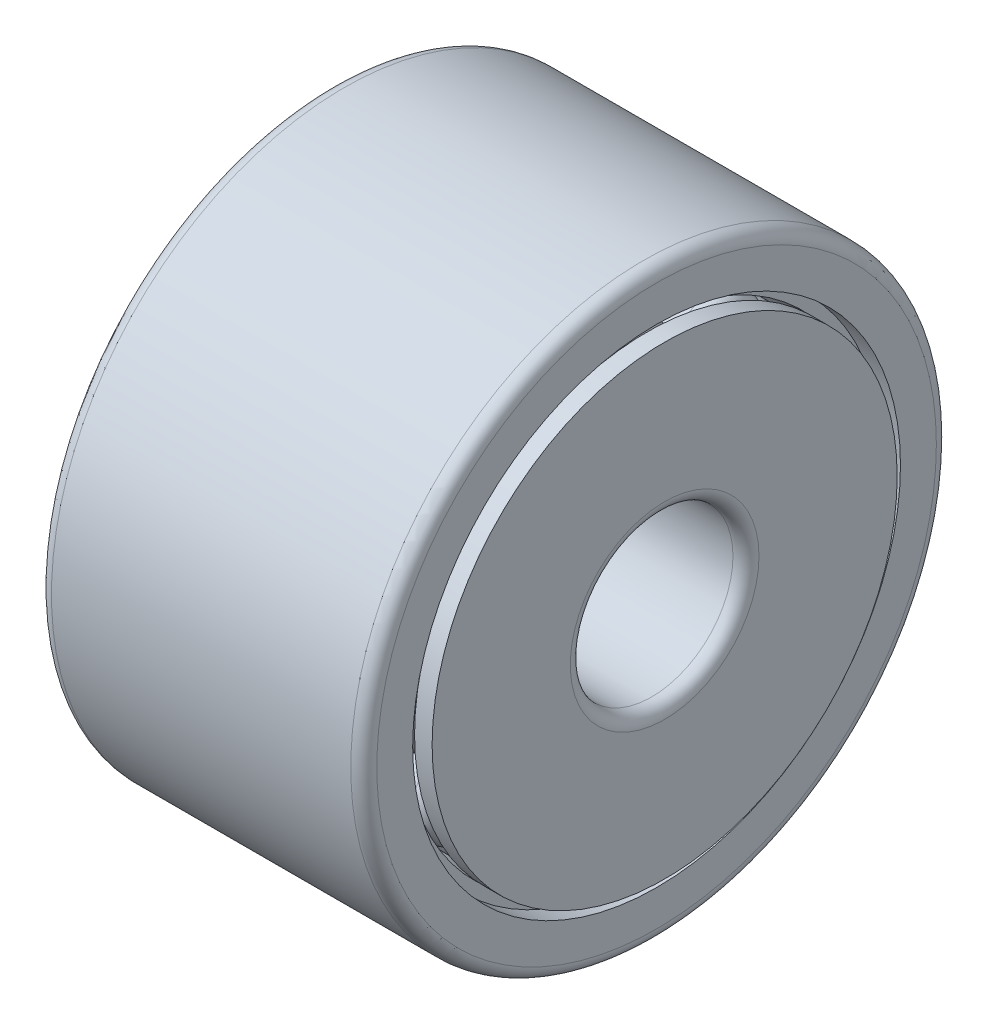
SolidWorks part; units mm, degrees
ref_plane "Plane1" through (0, 0, 0) normal (0, 0, 1) x (1, 0, 0)
ref_plane "Plane2" through (0, 0, 0) normal (0, 1, 0) x (1, 0, 0)
ref_plane "Plane3" through (0, 0, 0) normal (1, 0, 0) x (0, 0, -1)
other "Configuration Table"
sketch "Clipboard" plane through (0, 0, 0) normal (0, 0, 1) x (1, 0, 0)
  line L0 (-10, 0) -> (10, 0) construction
  line L1 (0, 0) -> (27.0344, -5.7463)
  line L2 (0, 0) -> (22.4793, 28.7722)
  line L3 (0, 0) -> (27.9428, -35.7651)
  line L4 (0, 0) -> (-22.3471, -0.7804)
sketch "OutRacSke" plane through (0, 0, 0) normal (0, 0, 1) x (1, 0, 0)
  line L0 (-14.0229, 22.6933) -> (-14.0229, 23.8026)
  line L1 (-14.0229, 23.8026) -> (-15.875, 23.8026)
  line L2 (-15.875, 23.8026) -> (-15.875, 27.305)
  line L3 (-14.605, 28.575) -> (14.605, 28.575)
  line L4 (15.875, 27.305) -> (15.875, 23.8026)
  line L5 (15.875, 23.8026) -> (14.0229, 23.8026)
  line L6 (14.0229, 23.8026) -> (14.0229, 22.6933)
  line L7 (14.0229, 22.6933) -> (-14.0229, 22.6933)
  line L8 (-7.9375, 0) -> (7.9375, 0) construction
  arc A0 (-15.875, 27.305) -> (-14.605, 28.575) centre (-14.605, 27.305) cw
  arc A1 (14.605, 28.575) -> (15.875, 27.305) centre (14.605, 27.305) cw
revolve "OuterRace" add sketch "OutRacSke" angle 360 about L8
sketch "RolDetSke" plane through (0, 0, 0) normal (0, 0, 1) x (1, 0, 0)
  line L0 (-14.0229, 20.9188) -> (-14.0229, 18.2562)
  line L1 (-14.0229, 18.2562) -> (14.0229, 18.2562)
  line L2 (14.0229, 18.2562) -> (14.0229, 20.9188)
  line L3 (12.2479, 22.6938) -> (-12.2479, 22.6938)
  line L4 (-28.575, 18.2562) -> (28.575, 18.2562) construction
  arc A0 (14.0229, 20.9188) -> (12.2479, 22.6938) centre (12.2479, 20.9188) ccw
  arc A1 (-12.2479, 22.6938) -> (-14.0229, 20.9188) centre (-12.2479, 20.9188) ccw
revolve "RollerDetailed" add sketch "RolDetSke" angle 360 about L4
ref_axis "Axis1" through (-50, 0, 0) along (1, 0, 0)
pattern_circular "RollersDetailed" count 12 every 30 about axis through (-50, 0, 0) along (1, 0, 0) of "RollerDetailed", "OuterRace"
sketch "RolSimSke" plane through (0, 25.4, 0) normal (0, 0, 1) x (1, 0, 0)
  line L0 (-14.0229, -4.4807) -> (-14.0229, -9.8058)
  line L1 (-25.4, -25.4) -> (25.4, -25.4) construction
  line L2 (14.0229, -9.8058) -> (14.0229, -4.4807)
  line L3 (12.2479, -2.7057) -> (-12.2479, -2.7057)
  line L5 (12.2479, -11.5808) -> (-12.2479, -11.5808)
  arc A0 (14.0229, -4.4807) -> (12.2479, -2.7057) centre (12.2479, -4.4807) ccw
  arc A1 (-12.2479, -2.7057) -> (-14.0229, -4.4807) centre (-12.2479, -4.4807) ccw
  arc A2 (14.0229, -9.8058) -> (12.2479, -11.5808) centre (12.2479, -9.8058) cw
  arc A3 (-12.2479, -11.5808) -> (-14.0229, -9.8058) centre (-12.2479, -9.8058) cw
revolve "RollersSimplified" [suppressed] add sketch "RolSimSke" angle 360 about L1
sketch "InsRacSke" plane through (0, 0, 0) normal (0, 0, 1) x (1, 0, 0)
  line L0 (-14.949, 13.8192) -> (-14.949, 22.6933)
  line L1 (-14.949, 22.6933) -> (-16.6624, 22.6933)
  line L2 (-16.6624, 22.6933) -> (-16.6624, 9.2075)
  line L3 (-15.3924, 7.9375) -> (-0.84, 7.9375)
  line L4 (0.84, 7.9375) -> (15.3924, 7.9375)
  line L5 (16.6624, 9.2075) -> (16.6624, 22.6933)
  line L6 (16.6624, 22.6933) -> (14.949, 22.6933)
  line L7 (14.949, 22.6933) -> (14.949, 13.8192)
  line L8 (14.949, 13.8192) -> (-14.949, 13.8192)
  line L9 (-7.9375, 0) -> (7.9375, 0) construction
  arc A0 (-16.6624, 9.2075) -> (-15.3924, 7.9375) centre (-15.3924, 9.2075) ccw
  arc A1 (-0.84, 7.9375) -> (0.84, 7.9375) centre (0, 6.985) cw
  arc A2 (15.3924, 7.9375) -> (16.6624, 9.2075) centre (15.3924, 9.2075) ccw
revolve "InnerRace" add sketch "InsRacSke" angle 360 about L9
equation "\"halfWidth@OutRacSke\" =  \"Width@OutRacSke\" / 2"
equation "\"CLdia@Clipboard\" =  ( \"Race_OD@Clipboard\" + \"Race_ID@Clipboard\" )  / 2"
equation "\"CLRad@RolDetSke\" = ( \"Race_OD@Clipboard\" + \"Race_ID@Clipboard\" )  / 4"
equation "\"Roller_diameter@RolDetSke\" =  ( \"Race_OD@Clipboard\" -  \"Race_ID@Clipboard\" )  / 2 + .001"
equation "\"Roller_diameter@RolSimSke\" = ( \"Race_OD@Clipboard\" -  \"Race_ID@Clipboard\" )  / 2 + .001"
equation "\"radius@RolDetSke\" = \"Roller_diameter@RolDetSke\" / 5"
equation "\"radius@RolSimSke\" = \"Roller_diameter@RolSimSke\" / 5"
equation "\"Cyl_Len@OutRacSke\" = \"Cyl_Len@RolDetSke\""
equation "\"Cyl_Len@RolSimSke\" = \"Cyl_Len@RolDetSke\""
equation "\"halfCylLen@RolDetSke\" = \"Cyl_Len@RolDetSke\" / 2"
equation "\"offset@InsRacSke\" = \"radius@InsRacSke\" * 0.75"
equation "\"SlotWidth@InsRacSke\" =  ( \"Width@OutRacSke\" + \"Cyl_Len@RolDetSke\" )  / 2"
equation "\"halfSlotWidth@InsRacSke\" = \"SlotWidth@InsRacSke\" / 2"
equation "\"D1@OutRacSke\" = \"Cyl_Len@OutRacSke\" / 2"
equation "\"Max_count@Clipboard\" = int( 3.14159265 / atn(( \"Roller_diameter@RolDetSke\" / 2) / sqr( \"CLRad@RolDetSke\"  *  \"CLRad@RolDetSke\" - ( \"Roller_diameter@RolDetSke\" / 2) *  ( \"Roller_diameter@RolDetSke\" / "
equation "\"Max_count@Clipboard\" = ((sgn( \"Max_count@Clipboard\" - \"Count@Clipboard\" )-1)*( \"Max_count@Clipboard\" - \"Count@Clipboard\" ))/-2+ \"Count@Clipboard\""
equation "\"Count@RollersDetailed\" = int( \"Show_count@Clipboard\" ) "
equation "\"Count@RollersDetailed\" = ((sgn( \"Count@RollersDetailed\" - \"Max_count@Clipboard\" )-1)*( \"Count@RollersDetailed\" - \"Max_count@Clipboard\" ))/-2+ \"Max_count@Clipboard\""
equation "\"Count@RollersDetailed\" = ((sgn( \"Count@RollersDetailed\" - \"Min_count@Clipboard\" )+1)*( \"Count@RollersDetailed\" - \"Min_count@Clipboard\"))/2 +\"Min_count@Clipboard\""
equation "\"Angle@RollersDetailed\" = 360.0 / \"Max_count@Clipboard\""
equation "\"Bore@RolSimSke\" = \"Race_ID@Clipboard\""
equation "\"Race_ID@InsRacSke\" = \"Race_ID@Clipboard\""
equation "\"Race_OD@InsRacSke\" = \"Race_OD@Clipboard\""
equation "\"halfWidth@InsRacSke\" = \"Width_IR@InsRacSke\" / 2"
equation "\"halfLength@RolSimSke\" = \"Cyl_Len@RolSimSke\" / 2"
equation "\"Race_OD@OutRacSke\" = \"Race_OD@Clipboard\""
